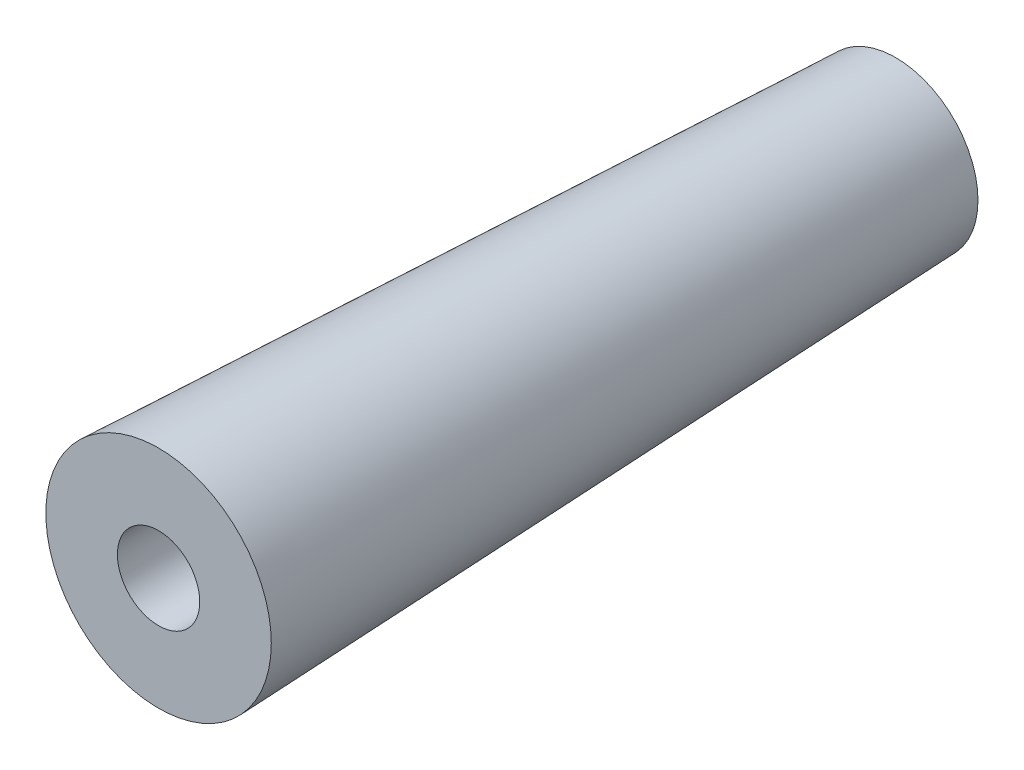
SolidWorks part; units mm, degrees
ref_plane "Plane1" through (0, 0, 0) normal (0, 0, 1) x (1, 0, 0)
ref_plane "Plane2" through (0, 0, 0) normal (0, 1, 0) x (1, 0, 0)
ref_plane "Plane3" through (0, 0, 0) normal (1, 0, 0) x (0, 0, -1)
sketch "Sketch1" plane through (0, 0, 0) normal (0, 0, 1) x (1, 0, 0)
  circle A0 centre (0, 0) radius 9.5
  dimension "D1" = 19
ref_plane "Plane4" through (0, 0, 85) normal (0, 0, 1) x (1, 0, 0)
sketch "Sketch2" plane through (0, 0, 85) normal (0, 0, 1) x (1, 0, 0)
  circle A0 centre (0, 0) radius 13
  dimension "D1" = 26
loft "Base-Loft" add profiles "Sketch1", "Sketch2"
sketch "Sketch3" plane through (0, 0, 85) normal (0, 0, 1) x (1, 0, 0)
  circle A0 centre (0, 0) radius 4.75
  dimension "D1" = 9.5
extrude "Cut-Extrude1" cut sketch "Sketch3" against normal through all
